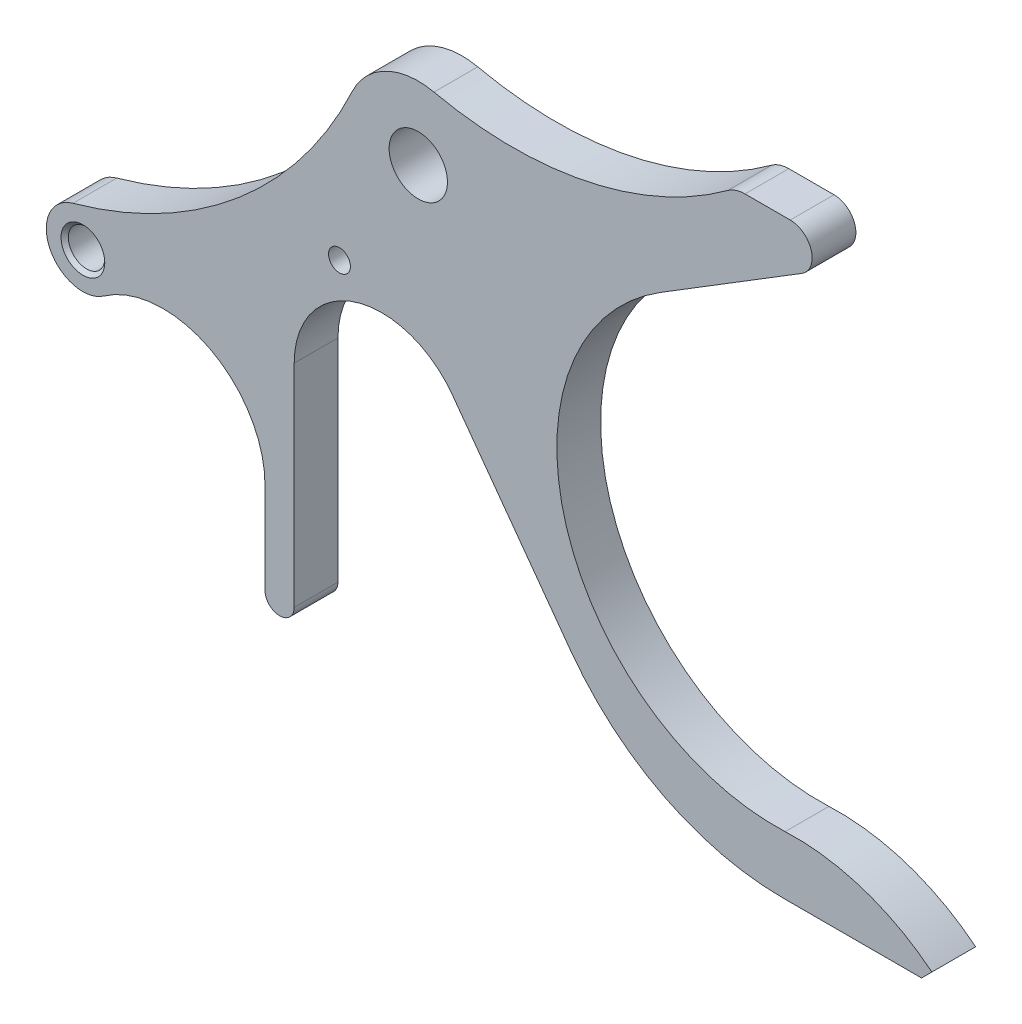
SolidWorks part; units mm, degrees
ref_plane "Face" through (0, 0, 0) normal (0, 0, 1) x (1, 0, 0)
ref_plane "Dessus" through (0, 0, 0) normal (0, 1, 0) x (1, 0, 0)
ref_plane "Droite" through (0, 0, 0) normal (1, 0, 0) x (0, 0, -1)
sketch "Esquisse1" plane through (0, 0, 0) normal (0, 0, 1) x (1, 0, 0)
  line L0 (-10.5057, -24.25) -> (-10.5057, -30.5)
  line L1 (-8.5057, -30.5) -> (-8.5057, -16)
  line L2 (2.3443, -12.4677) -> (10.45, -23.597)
  line L3 (25, -31) -> (34.5, -31)
  line L4 (22.4, 9.5) -> (25.5, 9.5)
  line L5 (16.6283, 0.7686) -> (26.2872, 6.7231)
  line L6 (34.5, -31) -> (35.2097, -30.2903)
  arc A0 (1.0773, 4.8826) -> (-4.5303, 2.1158) centre (0, 0) ccw
  arc A1 (-23.6701, -14.0915) -> (-21.5541, -18.5395) centre (-23, -16.5) ccw
  arc A2 (-23.6701, -14.0915) -> (-4.5303, 2.1158) centre (-31.7119, 14.8106) ccw
  arc A3 (-10.5057, -24.25) -> (-21.5541, -18.5395) centre (-17.5057, -24.25) ccw
  arc A4 (-10.5057, -30.5) -> (-8.5057, -30.5) centre (-9.5057, -30.5) ccw
  arc A5 (2.3443, -12.4677) -> (-8.5057, -16) centre (-2.5057, -16) ccw
  arc A6 (10.45, -23.597) -> (25, -31) centre (25, -13) ccw
  arc A7 (16.6283, 0.7686) -> (25.15, -26.9859) centre (24.5, -12) ccw
  arc A8 (35.2097, -30.2903) -> (25.15, -26.9859) centre (25.8, -41.9718) ccw
  arc A9 (26.2872, 6.7231) -> (25.5, 9.5) centre (25.5, 8) ccw
  arc A10 (22.4, 9.5) -> (21.2195, 9.1145) centre (22.4, 7.5) ccw
  arc A11 (1.0773, 4.8826) -> (21.2195, 9.1145) centre (6.4638, 29.2954) ccw
  dimension "D1" = 10
  dimension "D2" = 5
  dimension "D5" = 60
  dimension "D7" = 14
  dimension "D8" = 2
  dimension "D10" = 12
  dimension "D12" = 36
  dimension "D15" = 30
  dimension "D18" = 30
  dimension "D20" = 3
  dimension "D25" = 22.4
  dimension "D23" = 50
  dimension "D24" = 4
  dimension "D3" = 23
  dimension "D4" = 16.5
  dimension "D6" = 24.25
  dimension "D9" = 30.5
  dimension "D11" = 16
  dimension "D13" = 13
  dimension "D14" = 25
  dimension "D16" = 12
  dimension "D17" = 24.5
  dimension "D19" = 25.8
  dimension "D21" = 25.5
  dimension "D22" = 8
  dimension "D26" = 45
  dimension "D27" = 34.5
extrude "Extrusion1" add sketch "Esquisse1" along normal blind 3
sketch "Esquisse2" plane through (0, 0, 3) normal (0, 0, 1) x (1, 0, 0)
  circle A0 centre (0, 0) radius 2
  dimension "D1" = 4
extrude "Enlèv. mat.-Extru.1" cut sketch "Esquisse2" against normal through all
hole_wizard "Trou taraudé M3x0.52" positions "Esquisse3D3" profile "Esquisse5" tap size "M3x0.5" standard "ISO"
sketch3d "Esquisse3D3"
  point P4 (-22.99, -16.5232, 3)
sketch "Esquisse5" plane through (-22.99, -16.5232, 3) normal (1, 0, 0) x (0, -1, 0)
  line L0 (0, 0) -> (0, 8.2511)
  line L1 (0, 8.2511) -> (1.25, 7.5)
  line L2 (1.25, 7.5) -> (1.25, 0.25)
  line L3 (1.25, 0.25) -> (1.5, 0)
  line L5 (1.5, 0) -> (0, 0)
  line L6 (-1.25, 0.25) -> (-1.5, 0) construction
  line L10 (0, 8.2511) -> (-1.25, 7.5) construction
  line L11 (0, -6.35) -> (0, 107.95) construction
  dimension "Diamètre du trou pour taraudage" = 2.5
  dimension "Profondeur du trou pour taraudage" = 7.5
  dimension "Diamètre du fraisage entrant" = 3
  dimension "Angle du fraisage entrant" = 90
  dimension "Angle de pointe" = 118
sketch "Esquisse6" plane through (0, 0, 3) normal (0, 0, 1) x (1, 0, 0)
  circle A0 centre (-5.4, -8.34) radius 0.75
  dimension "D3" = 1.5
  dimension "D1" = 5.4
  dimension "D2" = 8.34
extrude "Enlèv. mat.-Extru.2" cut sketch "Esquisse6" against normal blind 10
